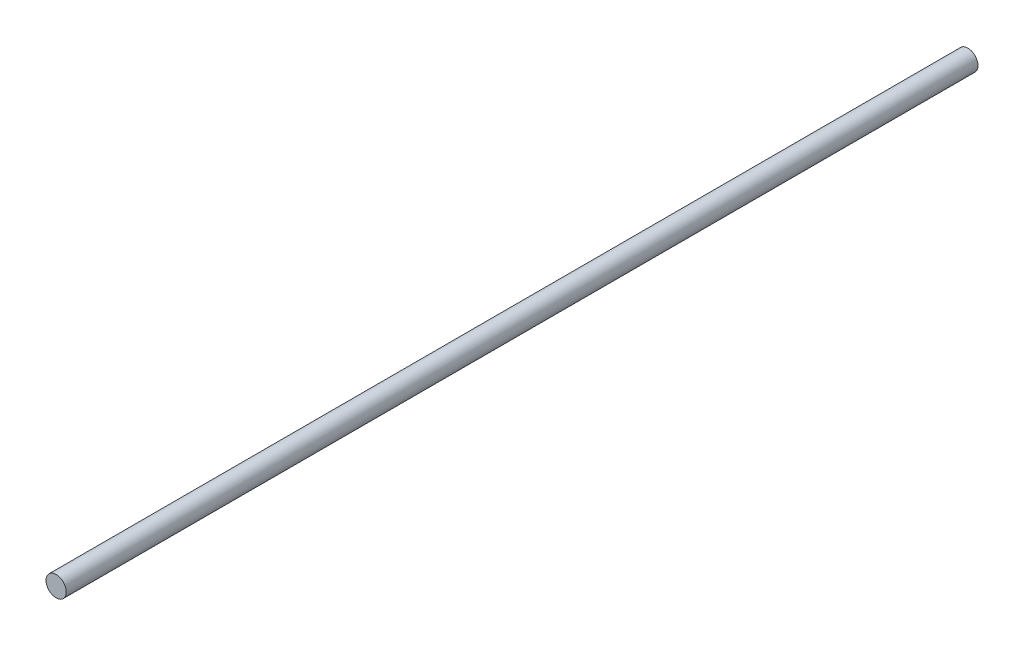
SolidWorks part; units mm, degrees
ref_plane "Front Plane" through (0, 0, 0) normal (0, 0, 1) x (1, 0, 0)
ref_plane "Top Plane" through (0, 0, 0) normal (0, 1, 0) x (1, 0, 0)
ref_plane "Right Plane" through (0, 0, 0) normal (1, 0, 0) x (0, 0, -1)
sketch "Sketch1" plane through (0, 0, 0) normal (0, 0, 1) x (1, 0, 0)
  circle A0 centre (0, 0) radius 30
  dimension "D1" = 60
extrude "Boss-Extrude1" add sketch "Sketch1" against normal blind 2700
